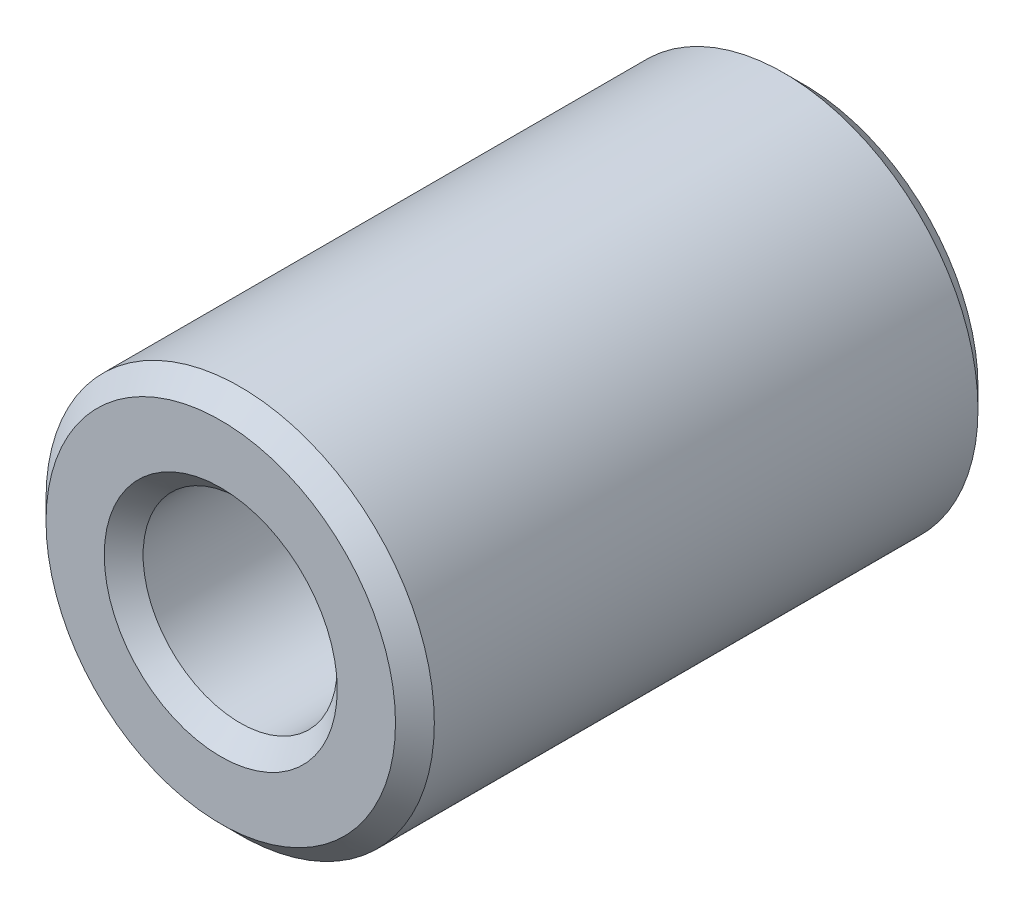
SolidWorks part; units mm, degrees
ref_plane "XY" through (0, 0, 0) normal (0, 0, 1) x (1, 0, 0)
ref_plane "XZ" through (0, 0, 0) normal (0, 1, 0) x (1, 0, 0)
ref_plane "YZ" through (0, 0, 0) normal (1, 0, 0) x (0, 0, -1)
sketch "Esquisse1" plane through (0, 0, 0) normal (0, 0, 1) x (1, 0, 0)
  circle A0 centre (0, 0) radius 5
  circle A1 centre (0, 0) radius 2.5
  dimension "D1" = 10
  dimension "D2" = 5
extrude "Corps" add sketch "Esquisse1" against normal blind 15
chamfer "Chanf" distance 0.5 angle 45
